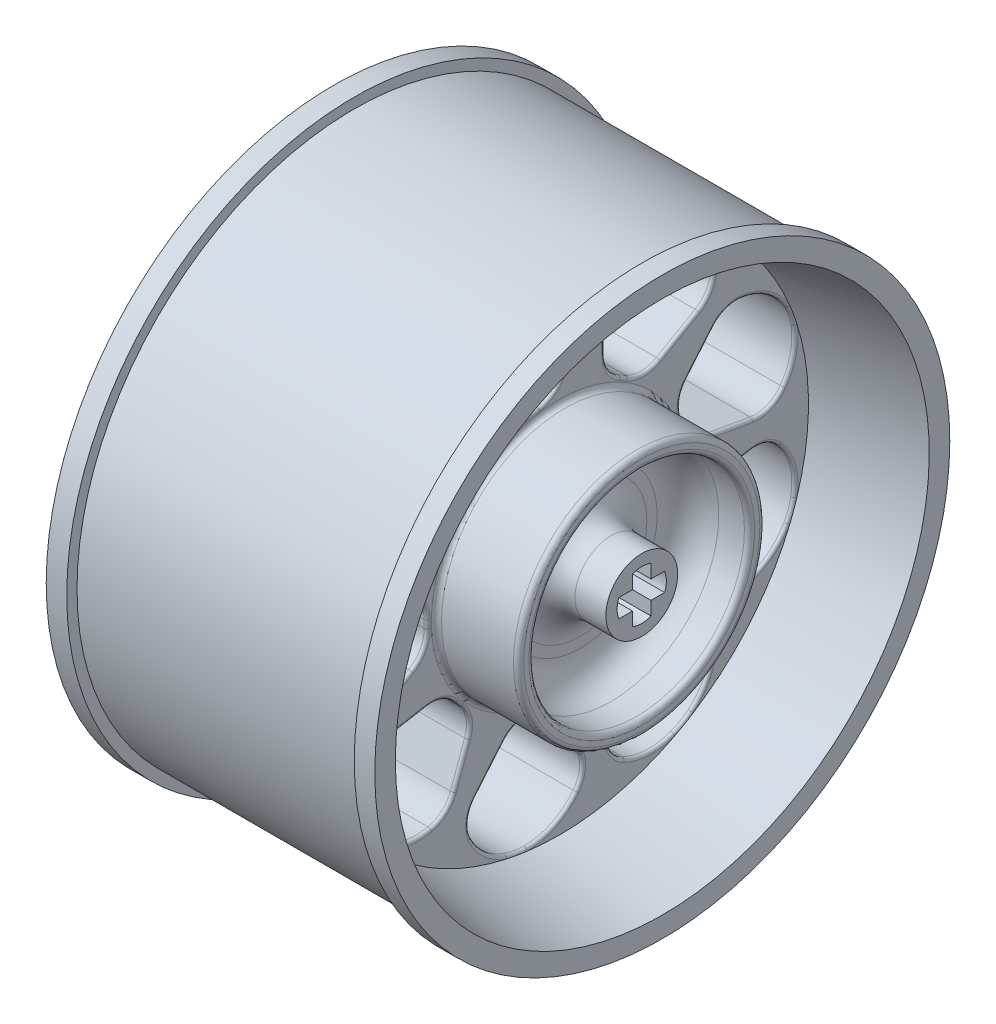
SolidWorks part; units mm, degrees
ref_plane "Front Plane" through (0, 0, 0) normal (0, 0, 1) x (1, 0, 0)
ref_plane "Top Plane" through (0, 0, 0) normal (0, 1, 0) x (1, 0, 0)
ref_plane "Right Plane" through (0, 0, 0) normal (1, 0, 0) x (0, 0, -1)
sketch "Sketch1" plane through (0, 0, 0) normal (0, 0, 1) x (1, 0, 0)
  line L0 (-109.8765, 0) -> (152.9653, 0) construction
  line L1 (-14, 0) -> (-14, 12)
  line L2 (-14, 12) -> (-6, 12)
  line L3 (-6, 12) -> (-6, 24.2367)
  line L4 (-6, 24.2367) -> (-16, 26)
  line L5 (-16, 26) -> (-16, 28)
  line L6 (-16, 28) -> (-14, 28)
  line L7 (16, 28) -> (16, 26)
  line L8 (16, 26) -> (6, 24.2367)
  line L9 (6, 24.2367) -> (6, 12)
  line L10 (6, 12) -> (14, 12)
  line L11 (14, 12) -> (14, 0)
  line L12 (0, 0) -> (0, 137.3104) construction
  line L13 (-14, 28) -> (-14, 27)
  line L14 (-14, 27) -> (14, 27)
  line L15 (14, 27) -> (14, 28)
  line L16 (14, 28) -> (16, 28)
  line L17 (-14, 0) -> (14, 0)
  dimension "D1" = 16
  dimension "D2" = 16
  dimension "D3" = 14
  dimension "D4" = 14
  dimension "D5" = 12
  dimension "D6" = 12
  dimension "D7" = 2
  dimension "D8" = 2
  dimension "D9" = 100
  dimension "D10" = 100
  dimension "D11" = 28
  dimension "D12" = 8
  dimension "D13" = 8
  dimension "D14" = 1
revolve "Revolve2" add sketch "Sketch1" angle 360 about L0
sketch "Sketch2" plane through (6, 0, 0) normal (1, 0, 0) x (0, 0, -1)
  line L0 (0, 0) -> (35.3988, 0) construction
  line L1 (0, 0) -> (19.8069, 34.3065) construction
  line L2 (4.4037, 19.4452) -> (4.4037, 12.1406)
  line L3 (14.7711, 13.947) -> (8.0734, 10.0801)
  arc A0 (8.0734, 10.0801) -> (4.4037, 12.1406) centre (0, 0) ccw
  circle A1 centre (0, 0) radius 24.2367 construction
  arc A2 (14.7711, 13.947) -> (4.4037, 19.4452) centre (9, 15.5885) ccw
  dimension "D2" = 12
  dimension "D3" = 18
  dimension "D1" = 60
  dimension "D4" = 30
  dimension "D5" = 60
extrude "Cut-Extrude3" cut sketch "Sketch2" against normal through all
fillet "Fillet2" radius 3 4 edges at (0, 10.0801, -8.0734) (0, 12.1406, -4.4037) (0, 13.947, -14.7711) (0, 19.4452, -4.4037)
fillet "Fillet3" radius 0.3 16 edges at (-6, 19.5796, -4.778) (-6, 20.942, -11.7092) (-6, 14.4021, -14.643) (-6, 12.1193, -11.6055) (-6, 10.6283, -8.1902) (-6, 11.2504, -6.3416) (-6, 12.5363, -4.836) (6, 19.5796, -4.778) (6, 20.942, -11.7092) (6, 14.4021, -14.643) (6, 12.1193, -11.6055) (6, 10.6283, -8.1902) (6, 11.2504, -6.3416) (6, 12.5363, -4.836) (-6, 16.1081, -4.4037) (6, 16.1081, -4.4037)
pattern_circular "CirPattern2" count 9 over 360 about axis through (0, 0, 0) along (1, 0, 0) of "Fillet3", "Fillet2", "Cut-Extrude3"
sketch "Sketch3" plane through (14, 0, 0) normal (1, 0, 0) x (0, 0, -1)
  line L0 (-3.166, 0) -> (3.882, 0) construction
  line L1 (0, 4.0978) -> (0, -4.681) construction
  line L2 (-2.2249, 0.9) -> (-0.9, 0.9)
  line L3 (-2.2249, -0.9) -> (-0.9, -0.9)
  line L4 (-0.9, 2.2249) -> (-0.9, 0.9)
  line L5 (0.9, 2.2249) -> (0.9, 0.9)
  line L6 (0.9, -0.9) -> (2.2249, -0.9)
  line L7 (0.9, -0.9) -> (0.9, -2.2249)
  line L8 (-0.9, -0.9) -> (-0.9, -2.2249)
  line L9 (0.9, 0.9) -> (2.2249, 0.9)
  arc A0 (-2.2249, 0.9) -> (-2.2249, -0.9) centre (0, 0) ccw
  arc A1 (0.9, 2.2249) -> (-0.9, 2.2249) centre (0, 0) ccw
  arc A2 (2.2249, -0.9) -> (2.2249, 0.9) centre (0, 0) ccw
  arc A3 (-0.9, -2.2249) -> (0.9, -2.2249) centre (0, 0) ccw
  dimension "D1" = 4.8
  dimension "D2" = 0.9
  dimension "D3" = 1.8
  dimension "D4" = 0.9
  dimension "D5" = 1.8
extrude "Cut-Extrude4" cut sketch "Sketch3" against normal through all
sketch "Sketch4" plane through (14, 0, 0) normal (1, 0, 0) x (0, 0, -1)
  circle A0 centre (0, 0) radius 10.5
  circle A1 centre (0, 0) radius 3.5
  dimension "D1" = 7
  dimension "D2" = 21
extrude "Cut-Extrude5" cut sketch "Sketch4" against normal blind 6
sketch "Sketch5" plane through (-14, 0, 0) normal (-1, 0, 0) x (0, 0, 1)
  circle A0 centre (0, 0) radius 3.5
  circle A1 centre (0, 0) radius 10.5
extrude "Cut-Extrude6" cut sketch "Sketch5" against normal blind 6
fillet "Fillet4" radius 3 4 edges at (8, 0, -3.5) (8, 0, -10.5) (-8, 0, 3.5) (-8, 0, 10.5)
fillet "Fillet7" radius 0.5 2 edges at (-6, 0, 12) (6, 0, 12)
fillet "Fillet8" radius 0.5 2 edges at (-14, 0, 10.5) (-14, 0, 12)
fillet "Fillet9" radius 0.5 2 edges at (14, 0, 12) (14, 0, -10.5)
